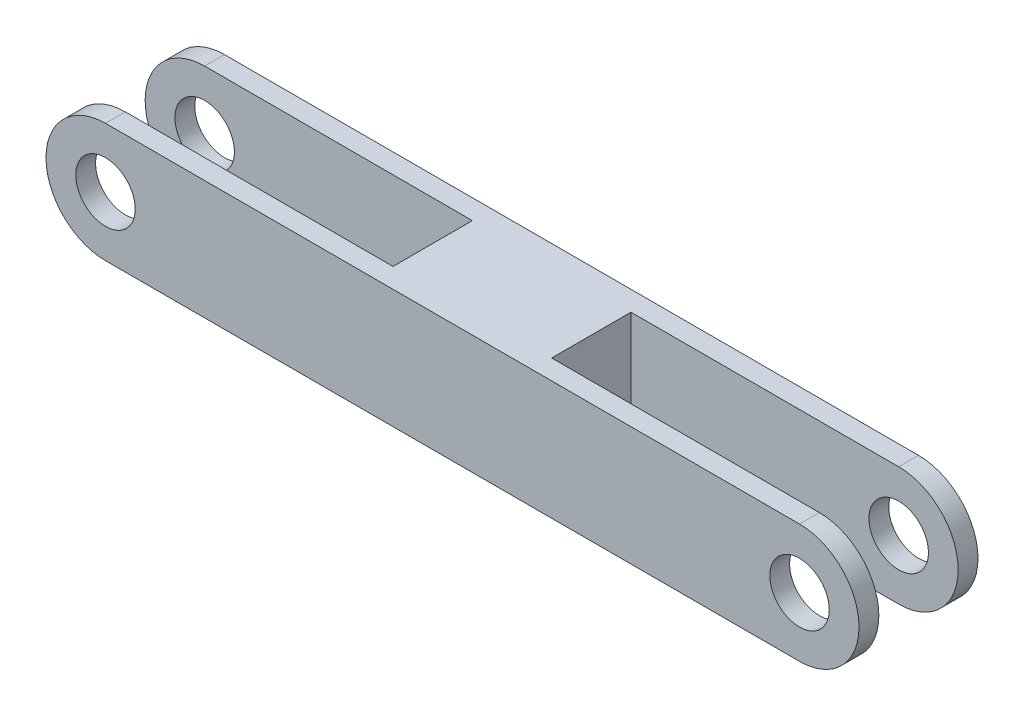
SolidWorks part; units mm, degrees
ref_plane "Front Plane" through (0, 0, 0) normal (0, 0, 1) x (1, 0, 0)
ref_plane "Top Plane" through (0, 0, 0) normal (0, 1, 0) x (1, 0, 0)
ref_plane "Right Plane" through (0, 0, 0) normal (1, 0, 0) x (0, 0, -1)
sketch "Sketch1" plane through (0, 0, 0) normal (0, 0, 1) x (1, 0, 0)
  line L0 (0, 0) -> (35, 0) construction
  line L1 (0, -3) -> (35, -3)
  line L2 (0, 3) -> (35, 3)
  arc A0 (0, -3) -> (0, 3) centre (0, 0) cw
  arc A1 (35, -3) -> (35, 3) centre (35, 0) ccw
  circle A2 centre (0, 0) radius 1.5
  circle A3 centre (35, 0) radius 1.5
  dimension "D4" = 3
  dimension "D1" = 35
  dimension "D2" = 3
  dimension "D3" = 3
extrude "Extrude1" add sketch "Sketch1" along normal mid plane 6
sketch "Sketch2" plane through (0, 3, 0) normal (0, 1, 0) x (-1, 0, 0)
  line L0 (-21.5, 2) -> (-38, 2)
  line L1 (-38, 3) -> (-38, -3) construction
  line L2 (-13.5, 2) -> (3, 2)
  line L3 (-38, 2) -> (-38, -2)
  line L4 (3, 2) -> (3, -2)
  line L6 (-17.5, 3) -> (-17.5, -3) construction
  line L7 (-35, 3) -> (0, 3) construction
  line L8 (-35, -3) -> (0, -3) construction
  line L9 (-38, -2) -> (-21.5, -2)
  line L10 (3, -2) -> (-13.5, -2)
  line L11 (-21.5, -2) -> (-21.5, 2)
  line L12 (-13.5, -2) -> (-13.5, 2)
  line L13 (-17.5, 0) -> (-21.5, 0) construction
  line L14 (-17.5, 0) -> (-13.5, 0) construction
  point P3 (-17.5, -2.0343)
  point P5 (-17.5, 1.6644)
  dimension "D1" = 4
  dimension "D2" = 4
extrude "Cut-Extrude1" cut sketch "Sketch2" against normal up to next
